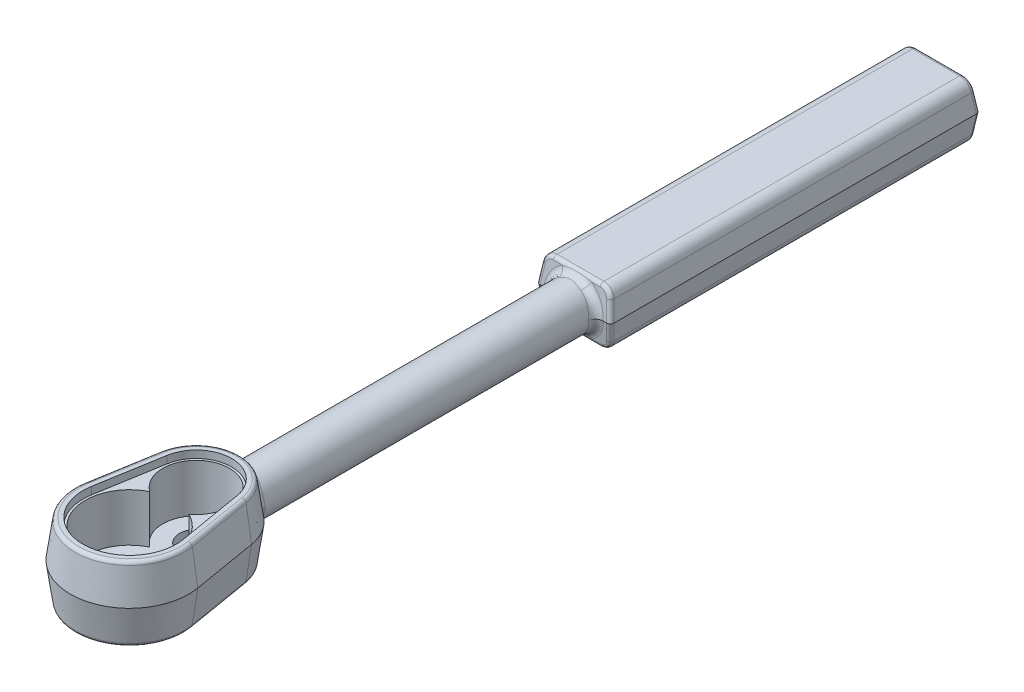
SolidWorks part; units mm, degrees
ref_plane "Front Plane" through (0, 0, 0) normal (0, 0, 1) x (1, 0, 0)
ref_plane "Top Plane" through (0, 0, 0) normal (0, 1, 0) x (1, 0, 0)
ref_plane "Right Plane" through (0, 0, 0) normal (1, 0, 0) x (0, 0, -1)
sketch "Sketch1" plane through (0, 0, 0) normal (0, 1, 0) x (1, 0, 0)
  line L0 (0, 0) -> (0, 220) construction
  line L1 (-10, 220) -> (10, 220)
  line L2 (10, 220) -> (10, 120)
  line L3 (-10, 220) -> (-10, 120)
  line L4 (10, 120) -> (-10, 120)
  point P7 (0, 120)
  dimension "D1" = 20
  dimension "D2" = 100
  dimension "D3" = 220
extrude "Handle" add sketch "Sketch1" along normal mid plane 15 draft 8
sketch "Sketch2" plane through (0, 0, 0) normal (0, 0, 1) x (1, 0, 0)
  circle A0 centre (0, 0) radius 6
  dimension "D1" = 12
extrude "Transition" add sketch "Sketch2" against normal up to next
sketch "Sketch3" plane through (0, 0, 0) normal (0, 1, 0) x (1, 0, 0)
  line L0 (-15.7762, 2.6667) -> (-12.8182, 20.1667)
  line L1 (12.8182, 20.1667) -> (15.7762, 2.6667)
  line L2 (0, 0) -> (0, 220) construction
  arc A0 (-12.8182, 20.1667) -> (12.8182, 20.1667) centre (0, 18) cw
  arc A1 (15.7762, 2.6667) -> (-15.7762, 2.6667) centre (0, 0) cw
  dimension "D1" = 13
  dimension "D2" = 16
  dimension "D3" = 18
extrude "Head" add sketch "Sketch3" along normal mid plane 20 draft 8
sketch "Sketch4" plane through (0, 10, 0) normal (0, 1, 0) x (1, 0, 0)
  line L4 (12.4184, 2.0991) -> (9.4604, 19.5991)
  line L5 (-9.4604, 19.5991) -> (-12.4184, 2.0991)
  line L6 (12.4184, 2.0991) -> (9.4604, 19.5991)
  line L7 (-9.4604, 19.5991) -> (-12.4184, 2.0991)
  arc A4 (-12.4184, 2.0991) -> (12.4184, 2.0991) centre (0, 0) ccw
  arc A5 (9.4604, 19.5991) -> (-9.4604, 19.5991) centre (0, 18) ccw
  arc A6 (-12.4184, 2.0991) -> (12.4184, 2.0991) centre (0, 0) ccw
  arc A7 (9.4604, 19.5991) -> (-9.4604, 19.5991) centre (0, 18) ccw
  dimension "D1" = 2
extrude "Recess" cut sketch "Sketch4" against normal blind 2
sketch "Sketch5" plane through (0, 8, 0) normal (0, 1, 0) x (1, 0, 0)
  arc A0 (5.3327, 10.75) -> (-5.3327, 10.75) centre (0, 18) ccw
  arc A1 (-5.3327, 10.75) -> (5.3327, 10.75) centre (0, 0) ccw
  arc A2 (-12.4184, 2.0991) -> (12.4184, 2.0991) centre (0, 0) ccw construction
  dimension "D1" = 9
  dimension "D2" = 12
extrude "Pocket" cut sketch "Sketch5" against normal offset from surface (13 mm away) 5
hole_wizard "Wheel Hole" positions "Sketch7" profile "Sketch6" hole size "Ø9.0" standard "ANSI Metric"
sketch "Sketch7" plane through (0, -5, 0) normal (0, 1, 0) x (1, 0, 0)
  point P0 (0, 18)
sketch "Sketch6" plane through (0, -5, -18) normal (1, 0, 0) x (0, 0, 1)
  line L0 (0, 0) -> (0, 5)
  line L1 (0, 5) -> (4.5, 5)
  line L2 (4.5, 5) -> (4.5, 0)
  line L5 (4.5, 0) -> (0, 0)
  line L11 (0, -6.35) -> (0, 107.95) construction
  dimension "Thru Hole Dia." = 9
  dimension "Thru Hole Depth" = 5
hole_wizard "Ratchet Hole" positions "Sketch9" profile "Sketch8" hole size "Ø12.0" standard "ANSI Metric"
sketch "Sketch9" plane through (0, -5, 0) normal (0, 1, 0) x (1, 0, 0)
  point P0 (0, 0)
sketch "Sketch8" plane through (0, -5, 0) normal (1, 0, 0) x (0, 0, 1)
  line L0 (0, 0) -> (0, 5)
  line L1 (0, 5) -> (6, 5)
  line L2 (6, 5) -> (6, 0)
  line L5 (6, 0) -> (0, 0)
  line L11 (0, -6.35) -> (0, 107.95) construction
  dimension "Thru Hole Dia." = 12
  dimension "Thru Hole Depth" = 5
fillet "Handle Fillets" radius 3 4 edges at (8.9459, -7.5, -170) (-8.9459, 7.5, -170) (8.9459, 7.5, -170) (-8.9459, -7.5, -170)
fillet "H End Fillets" radius 1 28 edges at (0, -10, 14.5946) (-12.9114, -10, -11.1824) (0, -10, -29.5946) (12.9114, -10, -11.1824) (0, 10, 14.5946) (12.9114, 10, -11.1824) (0, 10, -29.5946) (-12.9114, 10, -11.1824) (-9.6544, -2.4588, -219.6544) (-9.6544, -2.4588, -120.3456) (0, -7.5, -121.0541) (9.6544, -2.4588, -120.3456) (8.3063, -6.7641, -120.9506) (-8.3063, -6.7641, -120.9506) (0, -7.5, -218.9459) (9.6544, -2.4588, -219.6544) (8.3063, -6.7641, -219.0494) (-8.3063, -6.7641, -219.0494) (0, 7.5, -121.0541) (0, 7.5, -218.9459) (9.6544, 2.4588, -120.3456) (-9.6544, 2.4588, -120.3456) (8.3063, 6.7641, -120.9506) (-8.3063, 6.7641, -120.9506) (-9.6544, 2.4588, -219.6544) (9.6544, 2.4588, -219.6544) (8.3063, 6.7641, -219.0494) (-8.3063, 6.7641, -219.0494)
fillet "T-H Fillets" radius 2 4 edges at (0, -6, -120.8432) (0, 6, -120.8432) (0.1675, 5.9977, -30.1559) (0.1675, -5.9977, -30.1559)
